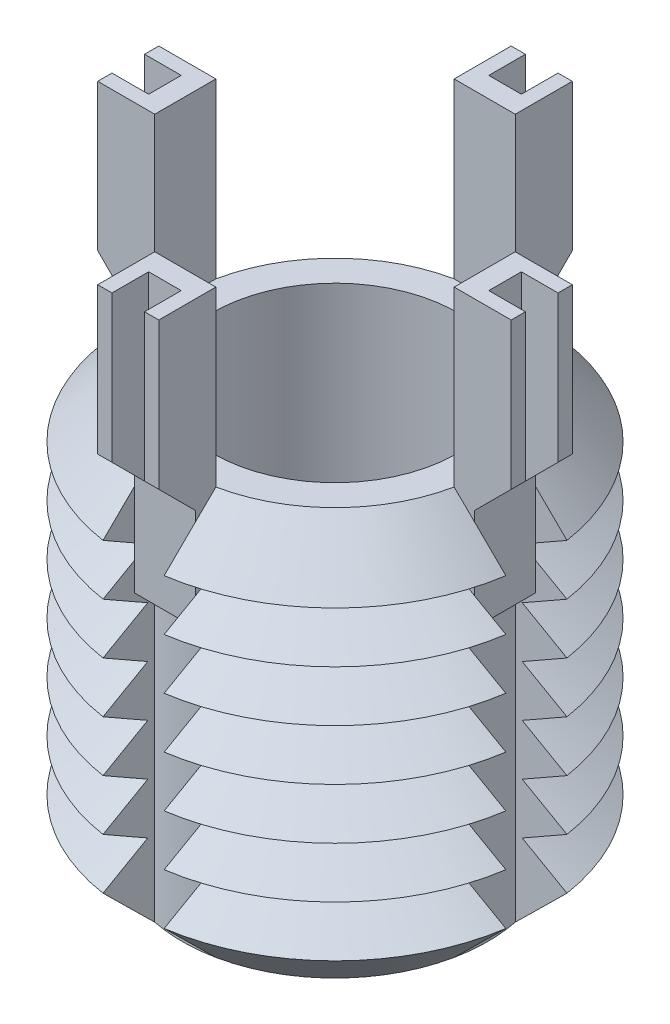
SolidWorks part; units mm, degrees
ref_plane "Front Plane" through (0, 0, 0) normal (0, 0, 1) x (1, 0, 0)
ref_plane "Top Plane" through (0, 0, 0) normal (0, 1, 0) x (1, 0, 0)
ref_plane "Right Plane" through (0, 0, 0) normal (1, 0, 0) x (0, 0, -1)
sketch "Sketch1" plane through (0, 0, 0) normal (0, 1, 0) x (1, 0, 0)
  circle A0 centre (0, 0) radius 5
  dimension "D1" = 10
extrude "Boss-Extrude1" add sketch "Sketch1" against normal blind 10
chamfer "Chamfer1" distance 1.25 angle 45 2 edges at (0, -10, 5) (0, 0, 5)
sketch "Sketch2" plane through (0, 0, 0) normal (1, 0, 0) x (0, 0, -1)
  line L0 (0, 0.8859) -> (0, -9.2617) construction
sketch "Sketch3" plane through (0, 0, 0) normal (1, 0, 0) x (0, 0, -1)
  line L0 (-5, -1.25) -> (-3.9175, -1.875)
  line L1 (-3.9175, -1.875) -> (-5, -2.5)
  line L2 (-5, -1.25) -> (-5, -8.75) construction
  line L3 (-5, -2.5) -> (-5, -1.25)
  dimension "D1" = 1.25
revolve "Cut-Revolve1" cut sketch "Sketch3" angle 360 about L0
pattern_linear "LPattern1" count 6 spacing 1.25 along (0, -1, 0) of "Cut-Revolve1"
sketch "Sketch4" plane through (0, 0, 0) normal (0, 1, 0) x (1, 0, 0)
  line L0 (-3.6742, 0.75) -> (-4.9434, 0.75)
  line L2 (-4.9434, -0.75) -> (-3.6742, -0.75)
  arc A0 (-3.6742, 0.75) -> (-3.6742, -0.75) centre (0, 0) ccw
  arc A1 (-4.9434, 0.75) -> (-4.9434, -0.75) centre (0, 0) ccw
  circle A2 centre (0, 0) radius 5 construction
  circle A3 centre (0, 0) radius 3.75 construction
  point P1 (-3.75, 0)
  point P3 (-5, 0)
  point P13 (0, 0)
  dimension "D1" = 1.5
extrude "Cut-Extrude1" cut sketch "Sketch4" against normal up to surface (10 mm away)
pattern_circular "CirPattern1" count 4 over 360 about axis through (0, 0, 0) along (0, 1, 0) of "Cut-Extrude1"
sketch "Sketch5" plane through (0, 0, 0) normal (1, 0, 0) x (0, 0, -1)
  line L0 (-3.6742, 4.25) -> (-3.6742, -2.75)
  line L1 (-3.6742, -2.75) -> (-4.1742, -2.75)
  line L2 (-4.1742, -2.75) -> (-4.1742, -0.25)
  line L3 (-4.1742, -0.25) -> (-5.0742, 0.65)
  line L4 (-5.0742, 0.65) -> (-5.0742, 4.25)
  line L5 (-5.0742, 4.25) -> (-3.6742, 4.25)
  line L6 (-4.9434, -3.75) -> (-0.75, -3.75) construction
  point P9 (-0.75, 0)
  point P10 (-4.1742, -0.25)
  dimension "D1" = 1
  dimension "D2" = 7
  dimension "D3" = 4.5
  dimension "D4" = 1.4
  dimension "D5" = 0.5
  dimension "D6" = 45
extrude "Boss-Extrude3" add sketch "Sketch5" along normal mid plane 1.5
pattern_circular "CirPattern2" count 4 over 360 about axis through (0, 0, 0) along (0, 1, 0) of "Boss-Extrude3"
sketch "Sketch6" plane through (0, 4.25, 0) normal (0, 1, 0) x (1, 0, 0)
  line L0 (-5.0742, -0.75) -> (-5.0742, 0.75) construction
  line L1 (-5.0742, -0.4) -> (-4.1742, -0.4)
  line L2 (-5.0742, -0.4) -> (-5.0742, 0.4)
  line L3 (-5.0742, 0.4) -> (-4.1742, 0.4)
  line L4 (-4.1742, -0.4) -> (-4.1742, 0.4)
  line L5 (-5.0742, -0.4) -> (-4.1742, 0.4) construction
  line L6 (-5.0742, 0.4) -> (-4.1742, -0.4) construction
  line L7 (5.0742, 0.75) -> (5.0742, -0.75) construction
  line L8 (-0.4, 4.1742) -> (0.4, 4.1742)
  line L9 (-0.4, 4.1742) -> (-0.4, 5.0742)
  line L10 (-0.4, 5.0742) -> (0.4, 5.0742)
  line L11 (0.4, 4.1742) -> (0.4, 5.0742)
  line L12 (-0.4, 4.1742) -> (0.4, 5.0742) construction
  line L13 (-0.4, 5.0742) -> (0.4, 4.1742) construction
  line L14 (4.1742, -0.4) -> (5.0742, -0.4)
  line L15 (4.1742, -0.4) -> (4.1742, 0.4)
  line L16 (4.1742, 0.4) -> (5.0742, 0.4)
  line L17 (5.0742, -0.4) -> (5.0742, 0.4)
  line L18 (4.1742, -0.4) -> (5.0742, 0.4) construction
  line L19 (4.1742, 0.4) -> (5.0742, -0.4) construction
  line L20 (-0.4, -5.0742) -> (0.4, -5.0742)
  line L21 (-0.4, -5.0742) -> (-0.4, -4.1742)
  line L22 (-0.4, -4.1742) -> (0.4, -4.1742)
  line L23 (0.4, -5.0742) -> (0.4, -4.1742)
  line L24 (-0.4, -5.0742) -> (0.4, -4.1742) construction
  line L25 (-0.4, -4.1742) -> (0.4, -5.0742) construction
  line L26 (-0.75, 5.0742) -> (0.75, 5.0742) construction
  line L27 (0.75, -5.0742) -> (-0.75, -5.0742) construction
  point P0 (-4.6242, 0)
  point P7 (-5.0742, 0)
  point P8 (-5.0742, 0)
  point P9 (0, 4.6242)
  point P14 (4.6242, 0)
  point P19 (0, -4.6242)
  point P24 (0, 5.0742)
  point P25 (5.0742, 0)
  point P26 (5.0742, 0)
  point P27 (0, 5.0742)
  point P30 (0, -5.0742)
  point P33 (0, -5.0742)
  dimension "D1" = 0.8
  dimension "D2" = 0.9
extrude "Cut-Extrude3" cut sketch "Sketch6" against normal through all both and the other way through all
sketch "Sketch7" plane through (0, 0, 0) normal (0, 1, 0) x (1, 0, 0)
  circle A0 centre (0, 0) radius 3
  dimension "D1" = 6
extrude "Cut-Extrude4" cut sketch "Sketch7" against normal up to surface (10 mm away)
